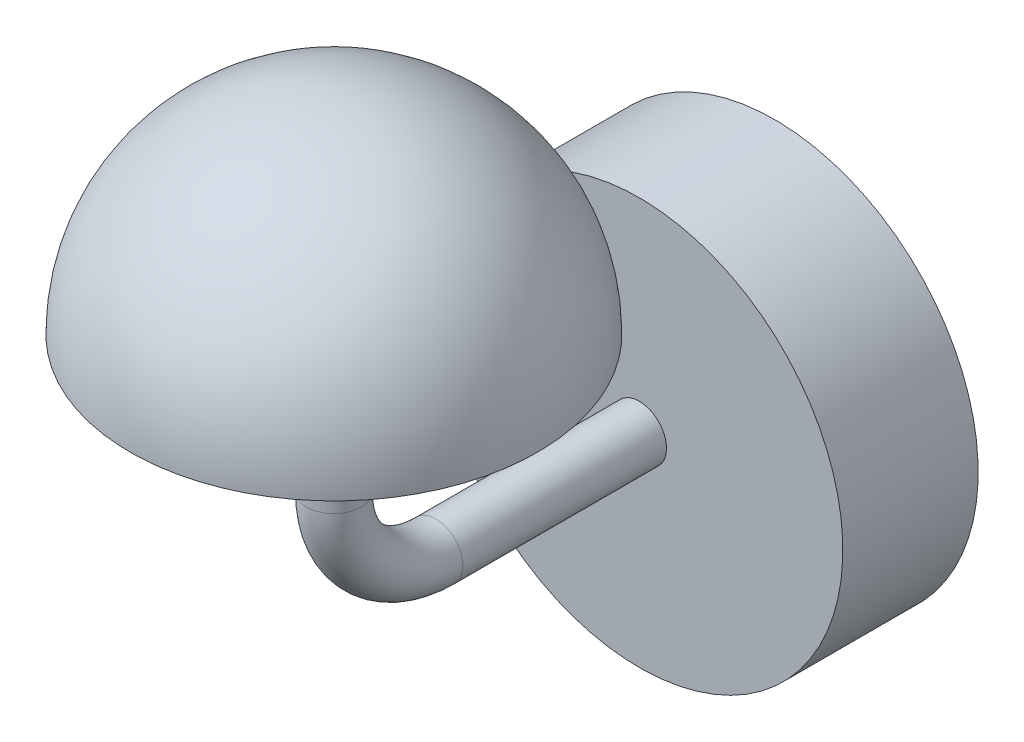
SolidWorks part; units mm, degrees
ref_plane "Alzado" through (0, 0, 0) normal (0, 0, 1) x (1, 0, 0)
ref_plane "Planta" through (0, 0, 0) normal (0, 1, 0) x (1, 0, 0)
ref_plane "Vista lateral" through (0, 0, 0) normal (1, 0, 0) x (0, 0, -1)
imported_body "Sólido importado3"
sketch "Croquis1" plane through (0, 0, 230.5) normal (0, 0, -1) x (-1, 0, 0)
  circle A0 centre (-11.3334, -58.8149) radius 8
extrude "Saliente-Extruir1" add sketch "Croquis1" along normal blind 60
ref_plane "Plano1" through (0, 0, 170.5) normal (0, 0, 1) x (1, 0, 0)
sketch "Croquis2" plane through (0, 0, 170.5) normal (0, 0, 1) x (1, 0, 0)
  circle A0 centre (11.3334, -58.8149) radius 59.944
  dimension "D1" = 119.888
extrude "Saliente-Extruir2" add sketch "Croquis2" against normal blind 39.878
sketch "Croquis4" plane through (0, -28.8149, 0) normal (0, 1, 0) x (-1, 0, 0)
  circle A0 centre (-11.3334, 260.5) radius 8
extrude "Saliente-Extruir4" add sketch "Croquis4" along normal blind 40
imported_body "Sólido importado4"
